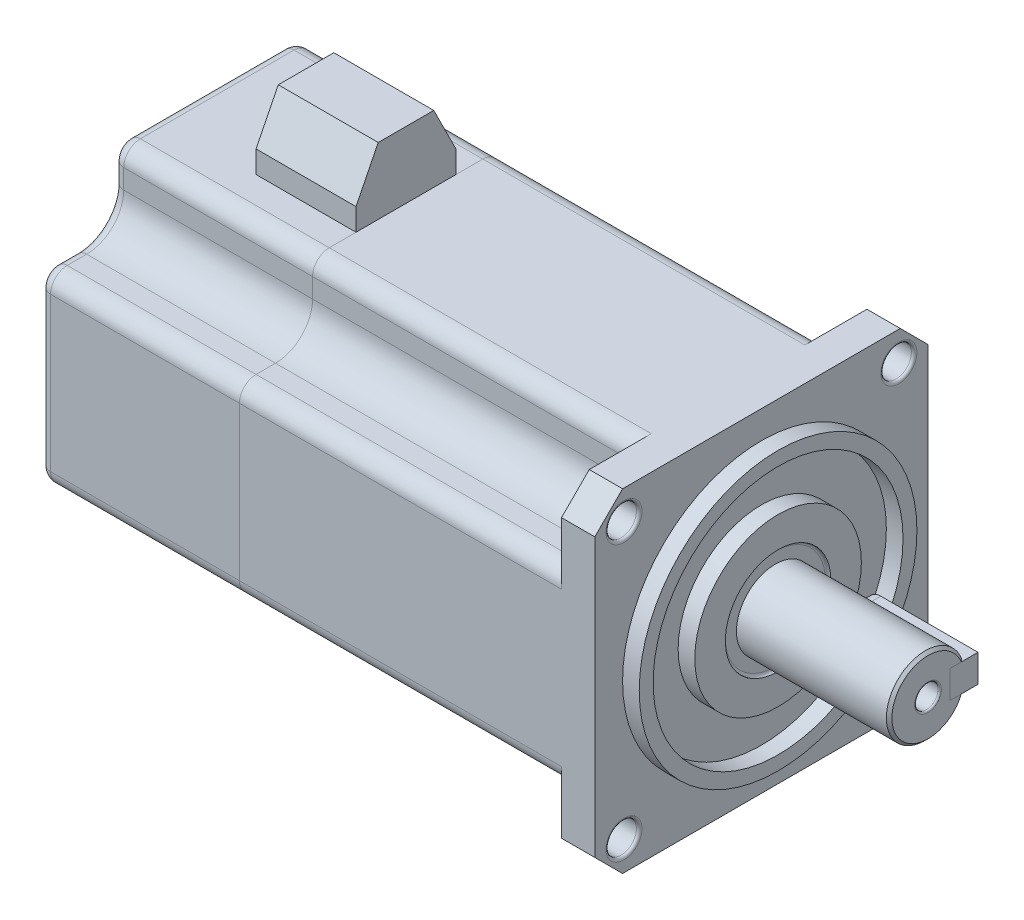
SolidWorks part; units mm, degrees
ref_plane "前视基准面" through (0, 0, 0) normal (0, 0, 1) x (1, 0, 0)
ref_plane "上视基准面" through (0, 0, 0) normal (0, 1, 0) x (1, 0, 0)
ref_plane "右视基准面" through (0, 0, 0) normal (1, 0, 0) x (0, 0, -1)
sketch "草图1" plane through (0, 0, 0) normal (1, 0, 0) x (0, 0, -1)
  line L0 (-30, 25) -> (-25, 30)
  line L1 (-25, -30) -> (25, -30)
  line L2 (-30, -25) -> (-30, 25)
  line L3 (-25, 30) -> (25, 30)
  line L4 (30, -25) -> (30, 25)
  line L5 (-30, -30) -> (30, 30) construction
  line L6 (-30, 30) -> (30, -30) construction
  line L7 (25, 30) -> (30, 25)
  line L8 (25, -30) -> (30, -25)
  line L9 (-30, -25) -> (-25, -30)
  point P0 (0, 0)
extrude "凸台-拉伸2" add sketch "草图1" against normal blind 64
sketch "草图2" plane through (-64, 0, 0) normal (-1, 0, 0) x (0, 0, 1)
  line L0 (-23.5, 16.8292) -> (-27, 16.8292)
  line L1 (-30, -25) -> (-30, 25) construction
  line L2 (-30, 13.8292) -> (-30, -13.8292)
  line L3 (-23.5, -16.8292) -> (-27, -16.8292)
  line L4 (-25, 30) -> (-30, 25)
  line L5 (-16.8292, -23.5) -> (-16.8292, -27)
  line L6 (25, -30) -> (-25, -30) construction
  line L7 (-13.8292, -30) -> (13.8292, -30)
  line L8 (30, -13.8292) -> (30, 13.8292)
  line L9 (16.8292, -23.5) -> (16.8292, -27)
  line L11 (-30, -25) -> (-30, -13.8292)
  line L12 (23.5, -16.8292) -> (27, -16.8292)
  line L13 (30, 25) -> (30, -25) construction
  line L14 (-30, -25) -> (-25, -30)
  line L15 (23.5, 16.8292) -> (27, 16.8292)
  line L16 (-25, -30) -> (-13.8292, -30)
  line L17 (16.8292, 23.5) -> (16.8292, 27)
  line L18 (-25, 30) -> (25, 30) construction
  line L19 (-13.8292, -30) -> (-13.8107, -29.8429)
  line L20 (13.8292, -30) -> (25, -30)
  line L21 (-16.8292, 23.5) -> (-16.8292, 27)
  line L22 (25, -30) -> (30, -25)
  line L23 (30, -25) -> (30, -13.8292)
  line L24 (30, 13.8292) -> (30, 25)
  line L25 (30, 25) -> (25, 30)
  line L26 (25, 30) -> (13.8292, 30)
  line L27 (-13.8292, 30) -> (-25, 30)
  line L28 (-30, 25) -> (-30, 13.8292)
  arc A0 (-23.5, 16.8292) -> (-16.8292, 23.5) centre (-23.5, 23.5) ccw
  arc A1 (16.8292, 23.5) -> (23.5, 16.8292) centre (23.5, 23.5) ccw
  arc A2 (23.5, -16.8292) -> (16.8292, -23.5) centre (23.5, -23.5) ccw
  arc A3 (-16.8292, -23.5) -> (-23.5, -16.8292) centre (-23.5, -23.5) ccw
  arc A4 (-27, 16.8292) -> (-30, 13.8292) centre (-27, 13.8292) ccw
  arc A5 (-27, -16.8292) -> (-30, -13.8292) centre (-27, -13.8292) cw
  arc A6 (-16.8292, -27) -> (-13.8292, -30) centre (-13.8292, -27) ccw
  arc A7 (16.8292, -27) -> (13.8292, -30) centre (13.8292, -27) cw
  arc A8 (27, -16.8292) -> (30, -13.8292) centre (27, -13.8292) ccw
  arc A9 (27, 16.8292) -> (30, 13.8292) centre (27, 13.8292) cw
  arc A10 (16.8292, 27) -> (13.8292, 30) centre (13.8292, 27) ccw
  arc A11 (-16.8292, 27) -> (-13.8292, 30) centre (-13.8292, 27) cw
  point P36 (-30, 16.8292)
  point P39 (-30, -16.8292)
  point P42 (-16.8292, -30)
  point P52 (16.8292, -30)
  point P55 (30, -16.8292)
  point P58 (30, 16.8292)
  point P61 (16.8292, 30)
  point P64 (-16.8292, 30)
  dimension "D1" = 3
extrude "切除-拉伸2" cut sketch "草图2" against normal blind 58 contours L21 A11 A4 L0 A0 M3 M4 M5 | A10 L17 A1 L15 A9 M1 M2 M3 | A8 L12 A2 L9 A7 M7 M8 M1 | A6 L5 A3 L3 A5 M5 M6 M7
sketch "草图4" plane through (0, 0, 0) normal (1, 0, 0) x (0, 0, -1)
  circle A1 centre (-24.7487, 24.7487) radius 2.75
  circle A2 centre (24.7487, 24.7487) radius 2.75
  circle A3 centre (24.7487, -24.7487) radius 2.75
  circle A4 centre (-24.7487, -24.7487) radius 2.75
extrude "切除-拉伸3" cut sketch "草图4" against normal blind 6
sketch "草图5" plane through (0, 0, 0) normal (1, 0, 0) x (0, 0, -1)
  circle A0 centre (0, 0) radius 25
  circle A1 centre (0, 0) radius 22.5
extrude "凸台-拉伸3" add sketch "草图5" along normal blind 3
sketch "草图6" plane through (0, 0, 0) normal (1, 0, 0) x (0, 0, -1)
  circle A0 centre (0, 0) radius 15
extrude "凸台-拉伸4" add sketch "草图6" along normal blind 3
sketch "草图7" plane through (3, 0, 0) normal (1, 0, 0) x (0, 0, -1)
  circle A0 centre (0, 0) radius 9.5
extrude "切除-拉伸4" cut sketch "草图7" against normal blind 0.5
fillet "圆角1" radius 0.5 1 edges at (2.5, 0, -9.5)
sketch "草图8" plane through (2.5, 0, 0) normal (1, 0, 0) x (0, 0, -1)
  circle A0 centre (0, 0) radius 7
extrude "凸台-拉伸5" add sketch "草图8" along normal blind 27.5
ref_plane "基准面1" through (0, 0, -7) normal (0, 0, 1) x (1, 0, 0)
sketch "草图10" plane through (0, 0, -7) normal (0, 0, 1) x (1, 0, 0)
  line L1 (30, -7) -> (30, 7) construction
  line L2 (12.5, -2.5) -> (30, -2.5)
  line L3 (30, -2.5) -> (30, 2.5)
  line L4 (30, 2.5) -> (12.5, 2.5)
  arc A0 (12.5, 2.5) -> (12.5, -2.5) centre (12.5, 0) ccw
extrude "切除-拉伸6" cut sketch "草图10" along normal blind 3
sketch "草图11" plane through (0, 0, -4) normal (0, 0, -1) x (-1, 0, 0)
  line L0 (-12.5, 2.5) -> (-30, 2.5)
  line L1 (-30, 2.5) -> (-30, -2.5)
  line L2 (-30, -2.5) -> (-12.5, -2.5)
  arc A0 (-12.5, -2.5) -> (-12.5, 2.5) centre (-12.5, 0) ccw
extrude "凸台-拉伸6" add sketch "草图11" along normal blind 5 separate body
chamfer "倒角1" distance 0.5 angle 45 1 edges at (30, 0, 7)
sketch "草图12" plane through (-64, 0, 0) normal (-1, 0, 0) x (0, 0, 1)
  line L0 (-23.5, 16.8292) -> (-27, 16.8292)
  line L1 (-30, 25) -> (-30, 13.8292) construction
  line L2 (-30, -13.8292) -> (-30, 13.8292)
  line L3 (-23.5, -16.8292) -> (-27, -16.8292)
  line L4 (-30, -13.8292) -> (-30, -25) construction
  line L5 (-13.8292, 30) -> (13.8292, 30)
  line L6 (-16.8292, -23.5) -> (-16.8292, -27)
  line L7 (-25, -30) -> (-13.8292, -30) construction
  line L8 (30, 13.8292) -> (30, -13.8292)
  line L9 (16.8292, -23.5) -> (16.8292, -27)
  line L10 (13.8292, -30) -> (25, -30) construction
  line L11 (13.8292, -30) -> (-13.8292, -30)
  line L12 (23.5, -16.8292) -> (27, -16.8292)
  line L13 (30, -25) -> (30, -13.8292) construction
  line L15 (23.5, 16.8292) -> (27, 16.8292)
  line L16 (30, 13.8292) -> (30, 25) construction
  line L18 (16.8292, 23.5) -> (16.8292, 27)
  line L19 (25, 30) -> (13.8292, 30) construction
  line L21 (-16.8292, 23.5) -> (-16.8292, 27)
  line L22 (-13.8292, 30) -> (-25, 30) construction
  arc A0 (-16.8292, -23.5) -> (-23.5, -16.8292) centre (-23.5, -23.5) ccw
  arc A1 (23.5, -16.8292) -> (16.8292, -23.5) centre (23.5, -23.5) ccw
  arc A2 (16.8292, 23.5) -> (23.5, 16.8292) centre (23.5, 23.5) ccw
  arc A3 (-23.5, 16.8292) -> (-16.8292, 23.5) centre (-23.5, 23.5) ccw
  arc A4 (-27, -16.8292) -> (-30, -13.8292) centre (-27, -13.8292) cw
  arc A5 (-16.8292, -27) -> (-13.8292, -30) centre (-13.8292, -27) ccw
  arc A6 (16.8292, -27) -> (13.8292, -30) centre (13.8292, -27) cw
  arc A7 (27, -16.8292) -> (30, -13.8292) centre (27, -13.8292) ccw
  arc A8 (27, 16.8292) -> (30, 13.8292) centre (27, 13.8292) cw
  arc A9 (16.8292, 27) -> (13.8292, 30) centre (13.8292, 27) ccw
  arc A10 (-16.8292, 27) -> (-13.8292, 30) centre (-13.8292, 27) cw
  arc A11 (-27, 16.8292) -> (-30, 13.8292) centre (-27, 13.8292) ccw
  point P5 (-30, -16.8292)
  point P20 (-16.8292, -30)
  point P53 (16.8292, -30)
  point P56 (30, -16.8292)
  point P59 (30, 16.8292)
  point P62 (16.8292, 30)
  point P65 (-16.8292, 30)
  point P68 (-30, 16.8292)
  dimension "D1" = 3
extrude "凸台-拉伸8" add sketch "草图12" along normal blind 36 separate body
fillet "圆角2" radius 2 24 edges at (-100, 18.783, -18.783) (-100, 15.9505, -29.1213) (-100, 29.1213, -15.9505) (-100, -15.9505, -29.1213) (-100, -18.783, -18.783) (-100, 29.1213, 15.9505) (-100, -29.1213, -15.9505) (-100, 18.783, 18.783) (-100, 15.9505, 29.1213) (-100, -29.1213, 15.9505) (-100, -18.783, 18.783) (-100, -15.9505, 29.1213) (-100, 0, -30) (-100, 30, 0) (-100, 0, 30) (-100, -30, 0) (-100, 16.8292, -25.25) (-100, 25.25, -16.8292) (-100, 25.25, 16.8292) (-100, 16.8292, 25.25) (-100, -16.8292, 25.25) (-100, -25.25, 16.8292) (-100, -25.25, -16.8292) (-100, -16.8292, -25.25)
hole_wizard "M5 螺纹孔1" positions "草图14" profile "草图13" tap size "M5" standard "GB"
sketch "草图14" plane through (30, 0, 0) normal (1, 0, 0) x (0, 0, -1)
  point P0 (0, 0)
sketch "草图13" plane through (30, 0, 0) normal (0, 1, 0) x (0, 0, -1)
  line L0 (0, 0) -> (0, 9.2618)
  line L1 (0, 9.2618) -> (2.1, 8)
  line L2 (2.1, 8) -> (2.1, 0)
  line L5 (2.1, 0) -> (0, 0)
  line L10 (0, 9.2618) -> (-2.1, 8) construction
  line L11 (0, -6.35) -> (0, 107.95) construction
  dimension "螺纹孔钻头直径" = 4.2
  dimension "螺纹孔钻头深度" = 8
  dimension "导头角度" = 118
sketch "草图15" plane through (0, 30, 0) normal (0, 1, 0) x (1, 0, 0)
  line L2 (-64, -13.8292) -> (-64, 13.8292) construction
  line L3 (-82, -9) -> (-64, -9)
  line L4 (-82, -9) -> (-82, 9)
  line L5 (-82, 9) -> (-64, 9)
  line L6 (-64, -9) -> (-64, 9)
  line L7 (-82, -9) -> (-64, 9) construction
  line L8 (-82, 9) -> (-64, -9) construction
extrude "凸台-拉伸10" add sketch "草图15" along normal blind 12 separate body
sketch "草图16" plane through (-64, 0, 0) normal (1, 0, 0) x (0, 0, -1)
  line L0 (-9, 42) -> (-5, 42)
  line L1 (-9, 42) -> (9, 42) construction
  line L3 (9, 42) -> (5, 42)
  line L6 (-9, 42) -> (-9, 30) construction
  line L7 (-9, 34) -> (-5, 42)
  line L9 (9, 42) -> (9, 30) construction
  line L10 (9, 34) -> (5, 42)
  line L11 (9, 42) -> (9, 34)
  line L12 (9, 34) -> (9.1371, 34.0978)
  line L13 (-9, 42) -> (-9, 34)
extrude "切除-拉伸7" cut sketch "草图16" against normal blind 18 contours L7 M4 M3 | L10 M2 M3
fillet "圆角3" radius 0.5 4 edges at (0, 24.7487, -27.4987) (0, -24.7487, -27.4987) (0, -24.7487, 21.9987) (0, 24.7487, 21.9987)
fillet "圆角4" radius 0.3 1 edges at (30, 0, -2.1)
